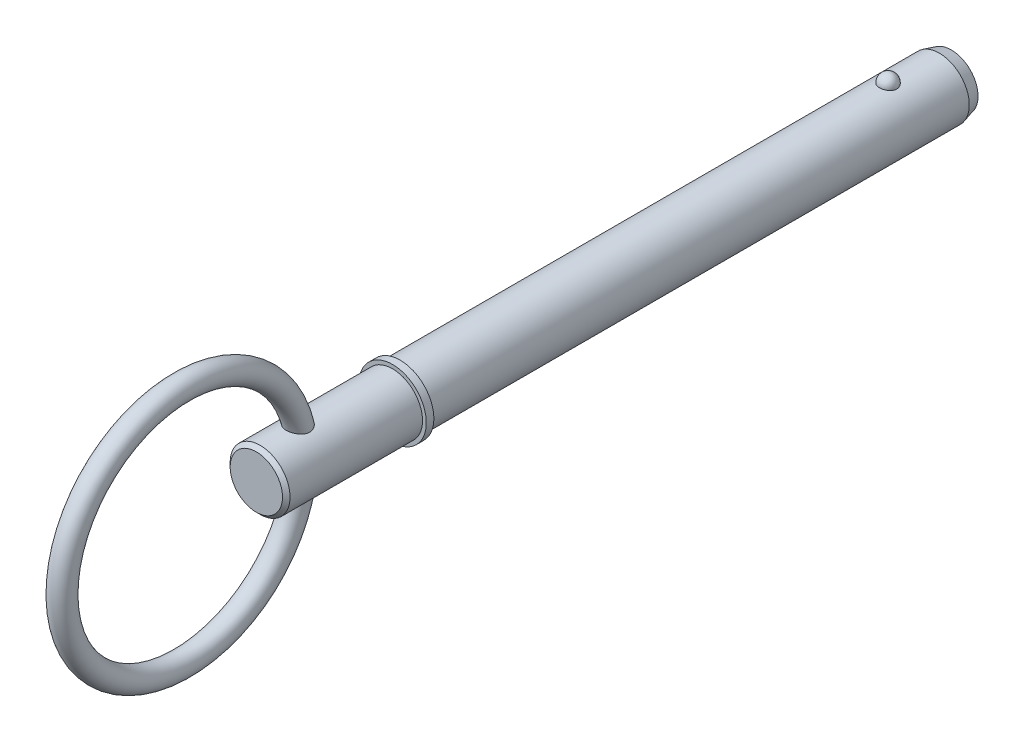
SolidWorks part; units mm, degrees
ref_plane "Front Plane" through (0, 0, 0) normal (0, 0, 1) x (1, 0, 0)
ref_plane "Top Plane" through (0, 0, 0) normal (0, 1, 0) x (1, 0, 0)
ref_plane "Right Plane" through (0, 0, 0) normal (1, 0, 0) x (0, 0, -1)
sketch "Sketch2" plane through (0, 0, 0) normal (0, 0, 1) x (1, 0, 0)
  circle A0 centre (0, 0) radius 3.97
  point P3 (0, 3.97)
  dimension "D1" = 7.94
extrude "Boss-Extrude1" add sketch "Sketch2" along normal blind 63.5
sketch "Sketch3" plane through (0, 0, 0) normal (0, 0, -1) x (-1, 0, 0)
  circle A0 centre (0, 0) radius 3.97
  dimension "D1" = 7.94
extrude "Boss-Extrude2" add sketch "Sketch3" along normal blind 9.53
chamfer "Chamfer1" distance 1.586 angle 15 1 edges at (-3.97, 0, -9.53)
sketch "Sketch18" plane through (0, 0, 0) normal (1, 0, 0) x (0, 0, -1)
  line L0 (7.944, 3.97) -> (-63.5, 3.97) construction
  line L1 (1.15, 5.12) -> (1.15, 2.82)
  line L2 (-63.5, -3.97) -> (7.944, -3.97) construction
  arc A0 (1.15, 5.12) -> (1.15, 2.82) centre (1.15, 3.97) ccw
  point P4 (0, 3.97)
  dimension "D1" = 9.09
revolve "Revolve1" add sketch "Sketch18" angle 360 about L1
sketch "Sketch19" plane through (0, 0, 0) normal (1, 0, 0) x (0, 0, -1)
  line L0 (-33.7288, 0) -> (-46.4542, 0) construction
sketch "Sketch20" plane through (0, 0, 0) normal (1, 0, 0) x (0, 0, -1)
  line L0 (-63.5, 0) -> (-63.5, 4.47)
  line L1 (-63.5, 3.97) -> (-63.5, -3.97) construction
  line L2 (-63.5, 4.47) -> (-64.5, 4.47)
  line L3 (-64.5, 4.47) -> (-64.5, 0)
  line L4 (-33.7288, 0) -> (-46.4542, 0) construction
  line L5 (-64.5, 0) -> (-63.5, 0)
  dimension "D1" = 4.47
  dimension "D2" = 1
revolve "Revolve2" add sketch "Sketch20" angle 360 about L0
sketch "Sketch21" plane through (0, 0, 63.5) normal (0, 0, -1) x (-1, 0, 0)
  circle A0 centre (0, 0) radius 3.97
  dimension "D1" = 7.94
extrude "Boss-Extrude3" add sketch "Sketch21" against normal blind 19.05
chamfer "Chamfer2" distance 0.5 angle 45 1 edges at (-3.97, 0, 82.55)
sketch "Sketch23" plane through (0, 0, 0) normal (1, 0, 0) x (0, 0, -1)
  line L0 (-82.55, 3.47) -> (-82.55, -3.47) construction
  circle A0 centre (-92.425, 0) radius 15.875
  point P2 (-76.55, 0)
  dimension "D1" = 31.75
  dimension "D2" = 6
sketch "Sketch24" plane through (0, 0, 0) normal (0, 1, 0) x (1, 0, 0)
  circle A0 centre (0, -76.55) radius 1.5
  dimension "D1" = 3
sweep "Sweep1" add profiles "Sketch24" path "Sketch23"
